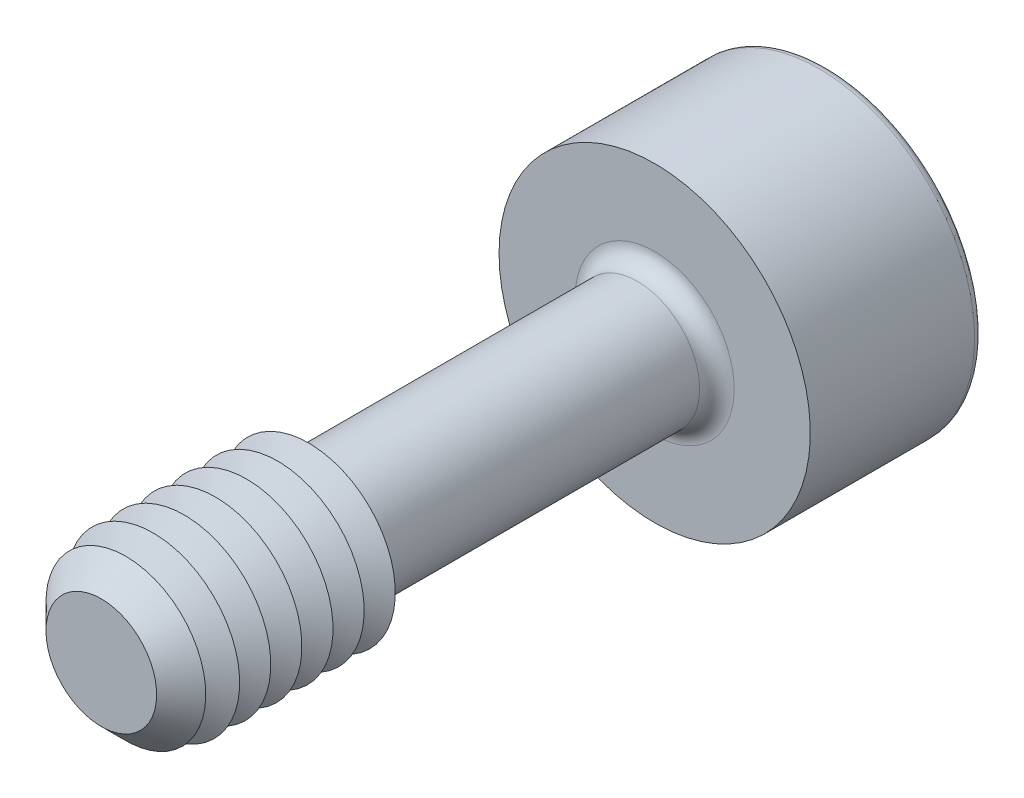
SolidWorks part; units mm, degrees
ref_plane "Front Plane" through (0, 0, 0) normal (0, 0, 1) x (1, 0, 0)
ref_plane "Top Plane" through (0, 0, 0) normal (0, 1, 0) x (1, 0, 0)
ref_plane "Right Plane" through (0, 0, 0) normal (1, 0, 0) x (0, 0, -1)
sketch "Sketch1" plane through (0, 0, 0) normal (0, 0, 1) x (1, 0, 0)
  circle A0 centre (0, 0) radius 0.9
  dimension "D1" = 1.8
extrude "Extrude1" add sketch "Sketch1" along normal mid plane 8
sketch "Sketch2" plane through (0, 0, 0) normal (1, 0, 0) x (0, 0, -1)
  line L0 (-4, 0) -> (-4, 1.25)
  line L1 (-4, 0.9) -> (-4, -0.9) construction
  line L2 (-4, 1.25) -> (-1, 1.25)
  line L3 (-1, 1.25) -> (-0.7979, 0.9)
  line L4 (4, 0.9) -> (-4, 0.9) construction
  line L5 (-0.7979, 0.9) -> (-0.7979, 0)
  line L6 (-0.7979, 0) -> (-4, 0)
  dimension "D1" = 1.25
  dimension "D2" = 120
  dimension "D3" = 3
revolve "Revolve1" add sketch "Sketch2" angle 360 about L6
chamfer "Chamfer1" distance 0.45 angle 45 1 edges at (0, 1.25, 4)
sketch "Sketch3" plane through (0, 0, -4) normal (0, 0, -1) x (-1, 0, 0)
  circle A0 centre (0, 0) radius 2.25
  dimension "D1" = 4.5
extrude "Extrude2" add sketch "Sketch3" along normal blind 2.5
sketch "Sketch4" plane through (-13.7, 0, -6.5) normal (0, 0, 1) x (1, 0, 0)
  line L2 (13.1226, -1) -> (14.2774, -1)
  line L3 (14.2774, -1) -> (14.8547, 0)
  line L4 (14.8547, 0) -> (14.2774, 1)
  line L6 (14.2774, 1) -> (13.1226, 1)
  line L7 (13.1226, 1) -> (12.5453, 0)
  line L8 (12.5453, 0) -> (13.1226, -1)
  circle A0 centre (13.7, 0) radius 1 construction
  dimension "D1" = 2
extrude "Extrude3" cut sketch "Sketch4" along normal blind 2
fillet "Fillet1" radius 0.25 1 edges at (-0.9, 0, -4)
fillet "Fillet2" radius 0.125 1 edges at (-2.25, 0, -6.5)
sketch "Sketch5" plane through (0, 0, 0) normal (1, 0, 0) x (0, 0, -1)
  line L0 (4.5, 0) -> (4.5, -1)
  line L1 (4.5, -1) -> (3.9226, 0)
  line L2 (3.9226, 0) -> (4.5, 0)
  dimension "D1" = 30
revolve "Cut-Revolve1" cut sketch "Sketch5" angle 360 about L2
sketch "Sketch6" plane through (0, 0, 0) normal (1, 0, 0) x (0, 0, -1)
  line L0 (1.332, 0) -> (-13.289, 0) construction
sketch "Sketch7" plane through (0, 0, 0) normal (1, 0, 0) x (0, 0, -1)
  line L0 (-1, 1.25) -> (-1.225, 0.8603)
  line L1 (-1.225, 0.8603) -> (-1.45, 1.25)
  line L2 (-1, 1.25) -> (-3.55, 1.25) construction
  line L3 (-1.45, 1.25) -> (-1, 1.25)
  dimension "D1" = 0.45
revolve "Cut-Revolve2" cut sketch "Sketch7" angle 360 about L0
pattern_linear "LPattern1" count 6 spacing 0.45 along (0, 0, 1) of "Cut-Revolve2"
